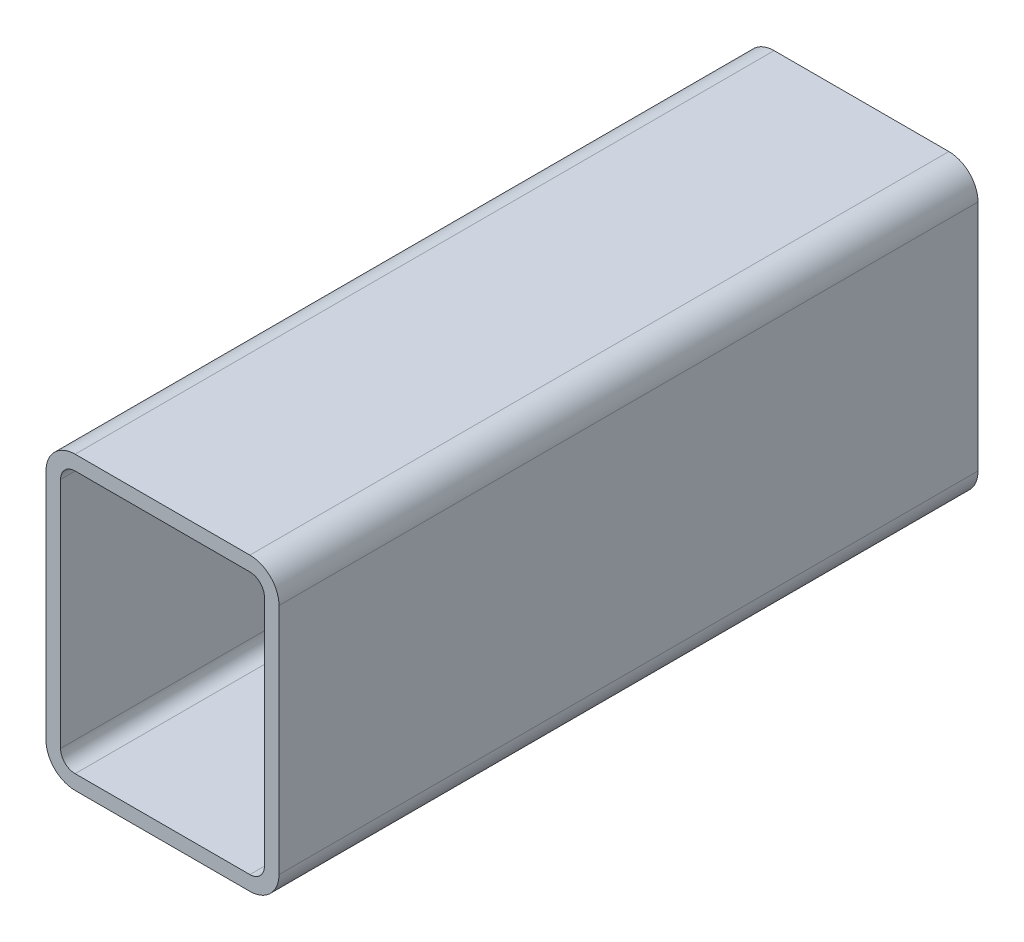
SolidWorks part; units mm, degrees
ref_plane "Front Plane" through (0, 0, 0) normal (0, 0, 1) x (1, 0, 0)
ref_plane "Top Plane" through (0, 0, 0) normal (0, 1, 0) x (1, 0, 0)
ref_plane "Right Plane" through (0, 0, 0) normal (1, 0, 0) x (0, 0, -1)
sketch "Sketch1" plane through (0, 0, 0) normal (0, 0, 1) x (1, 0, 0)
sketch_block_instance "HSS5x4x0.250-1"
sketch_block "HSS5x4x0.250"
extrude "Boss-Extrude1" add sketch "Sketch1" along normal blind 304.8
